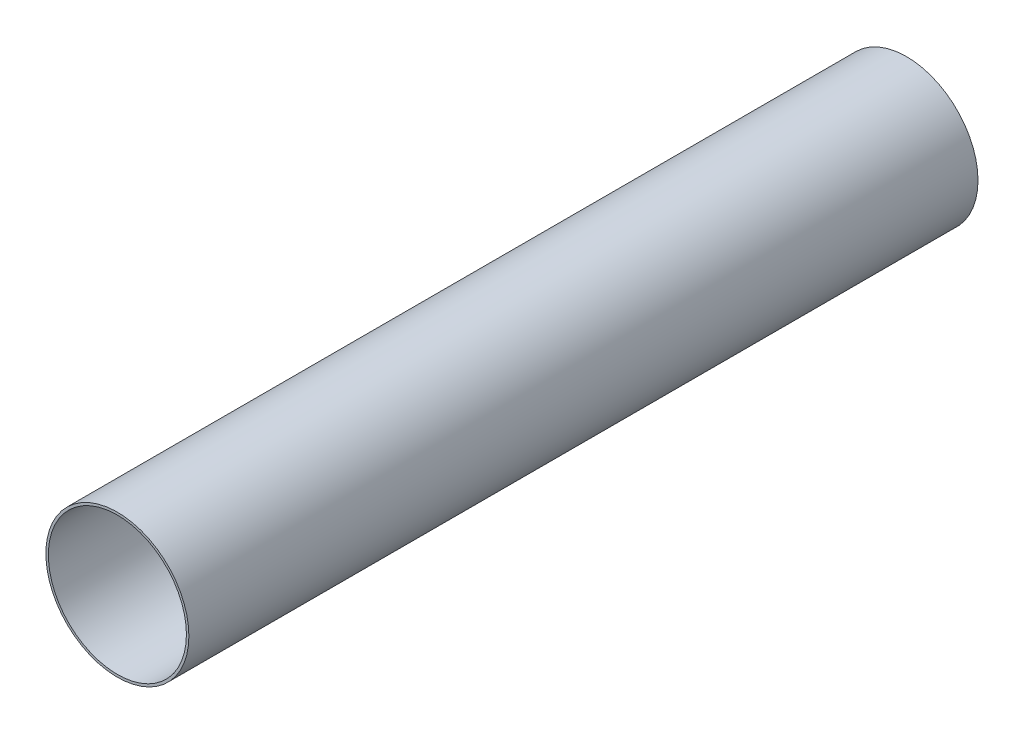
SolidWorks part; units mm, degrees
ref_plane "Front Plane" through (0, 0, 0) normal (0, 0, 1) x (1, 0, 0)
ref_plane "Top Plane" through (0, 0, 0) normal (0, 1, 0) x (1, 0, 0)
ref_plane "Right Plane" through (0, 0, 0) normal (1, 0, 0) x (0, 0, -1)
sketch "Sketch1" plane through (0, 0, 0) normal (0, 0, 1) x (1, 0, 0)
  circle A0 centre (0, 0) radius 23.0188
  circle A1 centre (0, 0) radius 22.225
  dimension "D1" = 44.45
  dimension "D2" = 46.0375
extrude "Extrude1" add sketch "Sketch1" along normal blind 254
